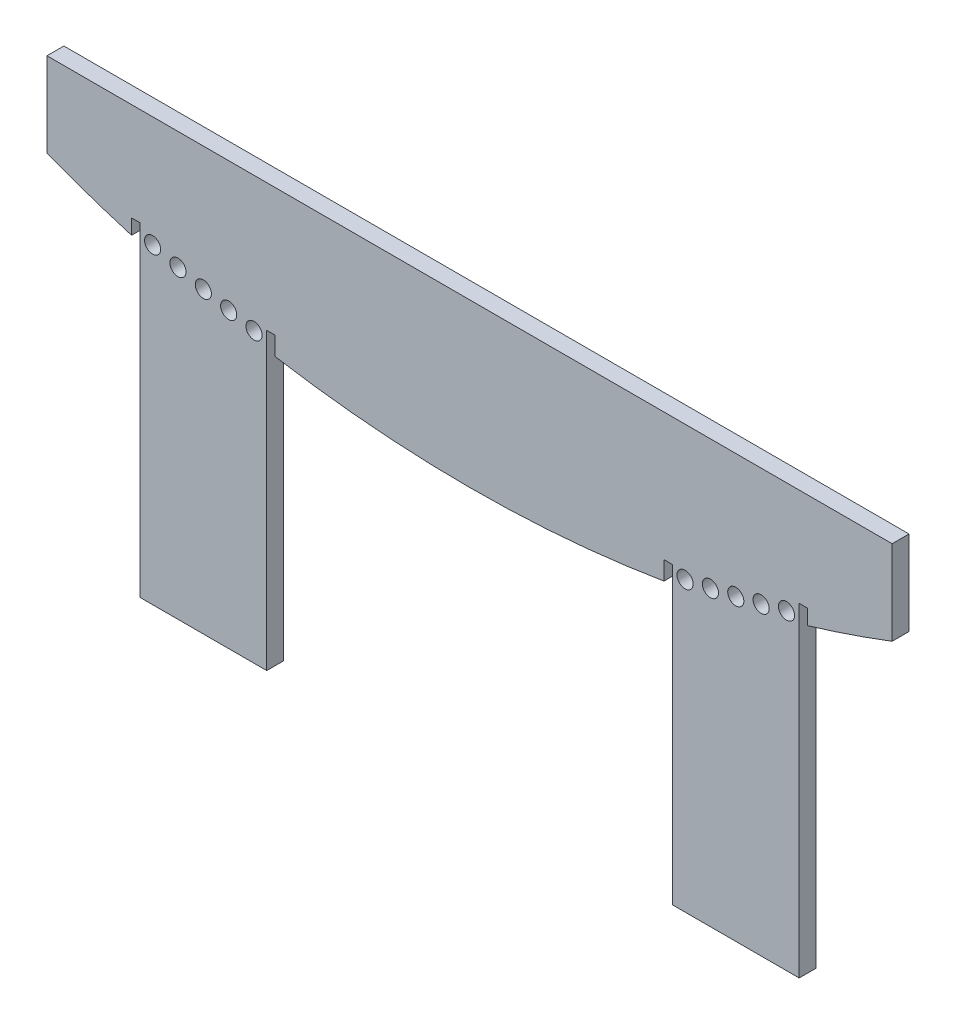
SolidWorks part; units mm, degrees
ref_plane "Ebene vorne" through (0, 0, 0) normal (0, 0, 1) x (1, 0, 0)
ref_plane "Ebene oben" through (0, 0, 0) normal (0, 1, 0) x (1, 0, 0)
ref_plane "Ebene rechts" through (0, 0, 0) normal (1, 0, 0) x (0, 0, -1)
sketch "Hauptteil" plane through (0, 0, 0) normal (0, 0, 1) x (1, 0, 0)
  line L0 (50, 0) -> (-50, 0)
  line L1 (-50, 0) -> (-50, -10)
  line L2 (50, 0) -> (50, -10)
  arc A0 (-50, -10) -> (50, -10) centre (0, 120.767) ccw
  dimension "D2" = 10
  dimension "D3" = 140
  dimension "D1" = 100
extrude "Linear austragen1" add sketch "Hauptteil" along normal blind 2
sketch "Skizze2" plane through (0, 0, 0) normal (0, 0, 1) x (1, 0, 0)
  line L0 (-39, -50) -> (-24, -50)
  line L1 (50, 0) -> (-50, 0) construction
  line L2 (-39, -11.6075) -> (-39, -50)
  line L3 (0, 0) -> (0, -30.1395) construction
  line L4 (-24, -15.1301) -> (-24, -50)
  line L5 (24, -15.1301) -> (24, -50)
  line L6 (39, -11.6075) -> (39, -50)
  line L7 (39, -50) -> (24, -50)
  arc A1 (39, -11.6075) -> (24, -15.1301) centre (0, 120.767) cw
  arc A2 (-49.2857, -8.1319) -> (49.2857, -8.1319) centre (0, 120.767) ccw
  arc A3 (-39, -11.6075) -> (-24, -15.1301) centre (0, 120.767) ccw
  dimension "D1" = 15
  dimension "D2" = 50
  dimension "D3" = 24
  dimension "D4" = 2
extrude "Linear austragen2" add sketch "Skizze2" along normal blind 2
sketch "Ausnehmung" plane through (0, 0, 0) normal (0, 0, 1) x (1, 0, 0)
  line L0 (-40, -11.6075) -> (-40, -50)
  line L1 (-23, -50) -> (-23, -15.1301)
  line L2 (23, -15.1301) -> (23, -50)
  line L3 (24, -15.1301) -> (24, -50)
  line L4 (24, -50) -> (39, -50)
  line L5 (39, -50) -> (39, -11.6075)
  line L6 (24, -15.1301) -> (24, -50)
  line L7 (40, -50) -> (40, -11.6075)
  line L8 (39, -50) -> (39, -11.6075)
  line L9 (-39, -50) -> (-24, -50)
  line L10 (-24, -50) -> (-24, -15.1301)
  line L11 (-39, -11.6075) -> (-39, -50)
  line L12 (-40, -50) -> (-39, -50)
  line L13 (-24, -50) -> (-24, -15.1301)
  line L14 (-39, -11.6075) -> (-39, -50)
  line L15 (-40, -11.6075) -> (-39, -11.6075)
  line L16 (-24, -15.1301) -> (-23, -15.1301)
  line L19 (-24, -50) -> (-23, -50)
  line L20 (23, -50) -> (24, -50)
  line L21 (39, -50) -> (40, -50)
  line L23 (24, -15.1301) -> (23, -15.1301)
  line L24 (40, -11.6075) -> (39, -11.6075)
  line L25 (50, 0) -> (-50, 0)
  line L26 (-50, 0) -> (-50, -10)
  line L27 (50, -10) -> (50, 0)
  arc A0 (24, -17.1605) -> (39, -13.6912) centre (0, 120.767) ccw construction
  arc A1 (24, -15.1301) -> (39, -11.6075) centre (0, 120.767) ccw
  arc A2 (-50, -10) -> (50, -10) centre (0, 120.767) ccw
  arc A3 (-39, -11.6075) -> (-24, -15.1301) centre (0, 120.767) ccw
  arc A4 (-39, -13.6912) -> (-24, -17.1605) centre (0, 120.767) ccw construction
  circle A5 centre (-37.5, -13.1266) radius 0.9541
  circle A6 centre (-25.5, -15.9206) radius 0.9541
  circle A7 centre (-34.5, -13.9308) radius 0.9541
  circle A8 centre (-31.5, -14.6638) radius 0.9541
  circle A9 centre (-28.5, -15.3267) radius 0.9541
  arc A10 (39, -13.6912) -> (24, -17.1605) centre (0, 120.767) cw construction
  circle A11 centre (28.5, -15.3267) radius 0.9541
  circle A12 centre (31.5, -14.6638) radius 0.9541
  circle A13 centre (34.5, -13.9308) radius 0.9541
  circle A14 centre (25.5, -15.9206) radius 0.9541
  circle A15 centre (37.5, -13.1266) radius 0.9541
  dimension "D5" = 1.5
  dimension "D6" = 1.5
  dimension "D7" = 3
  dimension "D8" = 3
  dimension "D9" = 3
  dimension "D1" = 0
  dimension "D2" = 0
  dimension "D3" = 1
  dimension "D4" = 0
extrude "Schnitt-Linear austragen2" cut sketch "Ausnehmung" along normal up to surface (2 mm away)
sketch "Skizze3" plane through (0, 0, 2) normal (0, 0, 1) x (1, 0, 0)
  line L4 (-23, -50) -> (-23, -15.1301)
  line L5 (-23, -15.1301) -> (-24, -15.1301)
  line L6 (-24, -15.1301) -> (-24, -50)
  line L7 (-24, -50) -> (-23, -50)
  line L8 (-23, -50) -> (-23, -15.1301) construction
  line L9 (-23, -15.1301) -> (-24, -15.1301) construction
  line L10 (-24, -15.1301) -> (-24, -50) construction
  line L11 (-24, -50) -> (-23, -50) construction
  line L12 (-40, -11.6075) -> (-40, -50)
  line L13 (-40, -50) -> (-39, -50)
  line L14 (-39, -50) -> (-39, -11.6075)
  line L15 (-39, -11.6075) -> (-40, -11.6075)
  line L16 (-40, -11.6075) -> (-40, -50) construction
  line L17 (-40, -50) -> (-39, -50) construction
  line L18 (-39, -50) -> (-39, -11.6075) construction
  line L19 (-39, -11.6075) -> (-40, -11.6075) construction
  line L20 (40, -50) -> (40, -11.6075)
  line L21 (40, -11.6075) -> (39, -11.6075)
  line L22 (39, -11.6075) -> (39, -50)
  line L23 (39, -50) -> (40, -50)
  line L24 (40, -50) -> (40, -11.6075) construction
  line L25 (40, -11.6075) -> (39, -11.6075) construction
  line L26 (39, -11.6075) -> (39, -50) construction
  line L27 (39, -50) -> (40, -50) construction
  line L28 (23, -15.1301) -> (23, -50)
  line L29 (24, -15.1301) -> (23, -15.1301)
  line L30 (24, -50) -> (24, -15.1301)
  line L31 (23, -50) -> (24, -50)
  line L32 (23, -15.1301) -> (23, -50) construction
  line L33 (24, -15.1301) -> (23, -15.1301) construction
  line L34 (24, -50) -> (24, -15.1301) construction
  line L35 (23, -50) -> (24, -50) construction
  circle A1 centre (-25.5, -15.9206) radius 0.9541
  circle A2 centre (-25.5, -15.9206) radius 0.9541 construction
  circle A3 centre (-37.5, -13.1266) radius 0.9541
  circle A4 centre (-37.5, -13.1266) radius 0.9541 construction
  circle A5 centre (25.5, -15.9206) radius 0.9541
  circle A6 centre (25.5, -15.9206) radius 0.9541 construction
  circle A7 centre (34.5, -13.9308) radius 0.9541
  circle A8 centre (34.5, -13.9308) radius 0.9541 construction
  circle A9 centre (31.5, -14.6638) radius 0.9541
  circle A10 centre (31.5, -14.6638) radius 0.9541 construction
  circle A11 centre (28.5, -15.3267) radius 0.9541
  circle A12 centre (28.5, -15.3267) radius 0.9541 construction
  circle A13 centre (-28.5, -15.3267) radius 0.9541
  circle A14 centre (-28.5, -15.3267) radius 0.9541 construction
  circle A15 centre (-31.5, -14.6638) radius 0.9541
  circle A16 centre (-31.5, -14.6638) radius 0.9541 construction
  circle A17 centre (-34.5, -13.9308) radius 0.9541
  circle A18 centre (-34.5, -13.9308) radius 0.9541 construction
  circle A19 centre (37.5, -13.1266) radius 0.9541
  circle A20 centre (37.5, -13.1266) radius 0.9541 construction
  dimension "D1" = 0
  dimension "D2" = 0
  dimension "D3" = 0
  dimension "D4" = 0
  dimension "D5" = 0
  dimension "D6" = 0
  dimension "D7" = 0
  dimension "D8" = 0
  dimension "D9" = 0
  dimension "D10" = 0
  dimension "D11" = 0
  dimension "D12" = 0
  dimension "D13" = 0
  dimension "D14" = 0
